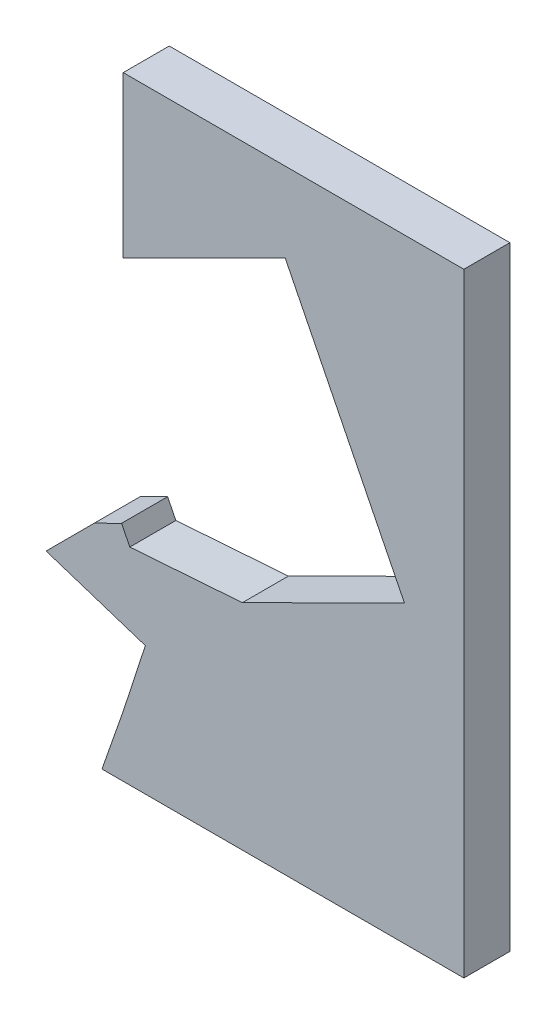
SolidWorks part; units mm, degrees
ref_plane "Front Plane" through (0, 0, 0) normal (0, 0, 1) x (1, 0, 0)
ref_plane "Top Plane" through (0, 0, 0) normal (0, 1, 0) x (1, 0, 0)
ref_plane "Right Plane" through (0, 0, 0) normal (1, 0, 0) x (0, 0, -1)
sketch "Sketch1" plane through (0, 0, 0) normal (0, 0, 1) x (1, 0, 0)
  line L0 (-21.6726, -14.7841) -> (-23.451, -19.8713)
  line L1 (-21.1473, -2.8062) -> (-21.8273, -1.4423)
  line L2 (-21.6921, 30.9287) -> (6.4992, 30.9287)
  line L3 (-21.6726, -14.7841) -> (-19.8632, -9.2294)
  line L4 (-28.0745, -6.5545) -> (-19.8632, -9.2294)
  line L5 (-23.451, -19.8713) -> (6.4992, -19.8713)
  line L6 (-21.6921, 17.641) -> (-21.6921, 30.9287)
  line L7 (-21.6921, 17.641) -> (-8.2806, 24.3277)
  line L8 (-11.832, -2.1352) -> (1.5795, 4.5515)
  line L9 (-8.2806, 24.3277) -> (1.5795, 4.5515)
  line L10 (-11.832, -2.1352) -> (-21.1473, -2.8062)
  line L11 (-24.1005, -2.5757) -> (-21.8273, -1.4423)
  line L12 (-28.0745, -6.5545) -> (-24.1005, -2.5757)
  line L13 (6.4992, 30.9287) -> (6.4992, -19.8713)
extrude "Extrude1" add sketch "Sketch1" along normal blind 3.81
